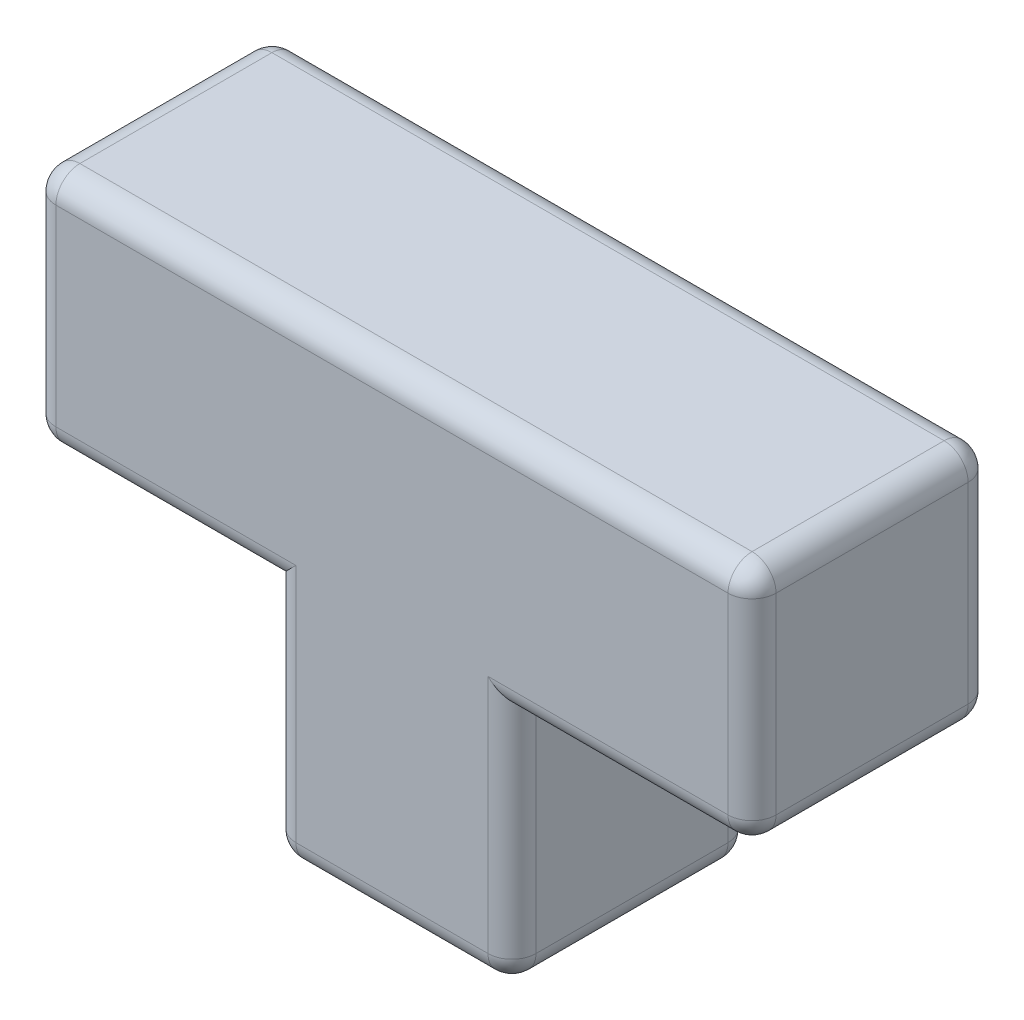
SolidWorks part; units mm, degrees
ref_plane "Front Plane" through (0, 0, 0) normal (0, 0, 1) x (1, 0, 0)
ref_plane "Top Plane" through (0, 0, 0) normal (0, 1, 0) x (1, 0, 0)
ref_plane "Right Plane" through (0, 0, 0) normal (1, 0, 0) x (0, 0, -1)
sketch "Sketch1" plane through (0, 0, 0) normal (0, 0, 1) x (1, 0, 0)
  line L1 (-326.4, 114.7403) -> (-26.4, 114.7403)
  line L2 (-326.4, 114.7403) -> (-326.4, 14.7403)
  line L3 (-326.4, 14.7403) -> (-226.4, 14.7403)
  line L4 (-26.4, 114.7403) -> (-26.4, 14.7403)
  line L9 (-126.4, 14.7403) -> (-26.4, 14.7403)
  line L11 (-226.4, 14.7403) -> (-226.4, -85.2597)
  line L12 (-226.4, -85.2597) -> (-126.4, -85.2597)
  line L13 (-126.4, 14.7403) -> (-126.4, -85.2597)
  dimension "D1" = 100
  dimension "D2" = 300
  dimension "D3" = 100
  dimension "D4" = 100
  dimension "D5" = 100
extrude "Boss-Extrude1" add sketch "Sketch1" along normal blind 100
fillet "Fillet3" radius 10 22 edges at (-276.4, 14.7403, 0) (-26.4, 64.7403, 0) (-326.4, 14.7403, 50) (-326.4, 64.7403, 0) (-26.4, 64.7403, 100) (-276.4, 14.7403, 100) (-326.4, 64.7403, 100) (-26.4, 114.7403, 50) (-176.4, 114.7403, 100) (-326.4, 114.7403, 50) (-176.4, 114.7403, 0) (-226.4, -35.2597, 0) (-176.4, -85.2597, 0) (-126.4, -35.2597, 0) (-76.4, 14.7403, 0) (-76.4, 14.7403, 100) (-126.4, -35.2597, 100) (-176.4, -85.2597, 100) (-226.4, -35.2597, 100) (-26.4, 14.7403, 50) (-226.4, -85.2597, 50) (-126.4, -85.2597, 50)
